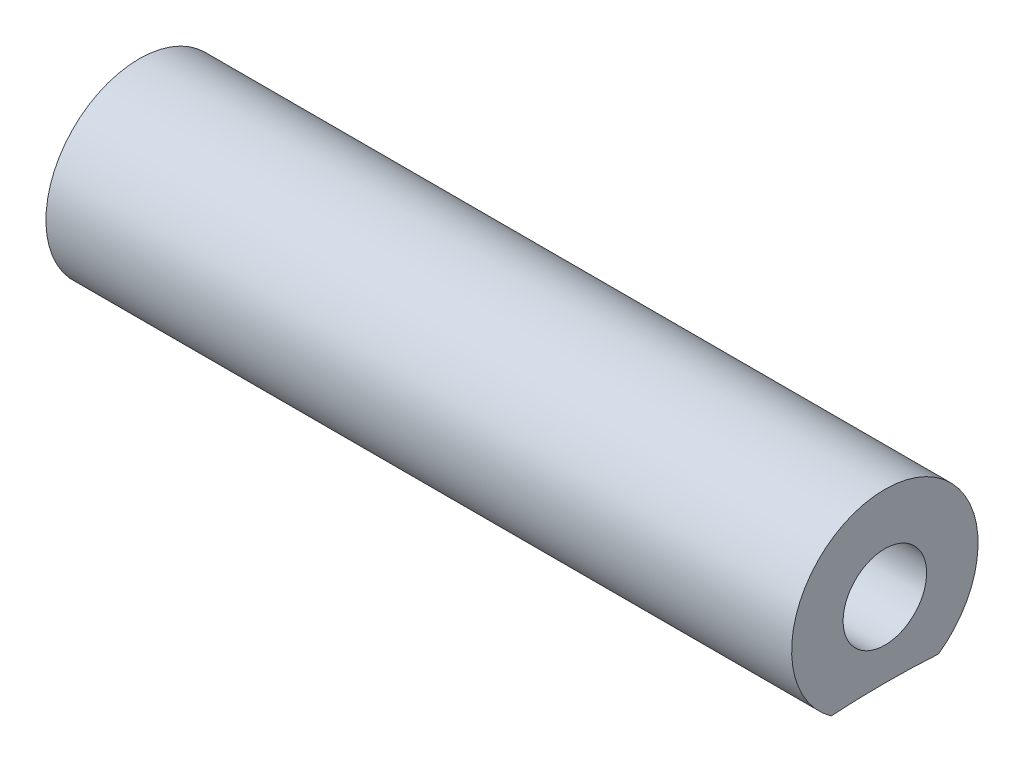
SolidWorks part; units mm, degrees
ref_plane "Front Plane" through (0, 0, 0) normal (0, 0, 1) x (1, 0, 0)
ref_plane "Top Plane" through (0, 0, 0) normal (0, 1, 0) x (1, 0, 0)
ref_plane "Right Plane" through (0, 0, 0) normal (1, 0, 0) x (0, 0, -1)
sketch "Sketch1" plane through (0, 0, 0) normal (1, 0, 0) x (0, 0, -1)
  circle A0 centre (0, 0) radius 3.175
  dimension "D1" = 6.35
extrude "Extrude1" add sketch "Sketch1" along normal blind 25.4
sketch "Sketch2" plane through (0, 0, 0) normal (-1, 0, 0) x (0, 0, 1)
  circle A0 centre (0, -31.623) radius 29.083
  circle A1 centre (0, 0) radius 3.175 construction
  dimension "D1" = 58.166
  dimension "D2" = 31.623
extrude "Cut-Extrude1" cut sketch "Sketch2" against normal through all
hole_wizard "#4-40 Tapped Hole1" positions "Sketch6" profile "Sketch5" tap size "#4-40" standard "Ansi Inch"
sketch "Sketch6" plane through (0, 0, 0) normal (1, 0, 0) x (0, 0, -1)
  point P0 (0, 0)
sketch "Sketch5" plane through (0, 0, 0) normal (0, 1, 0) x (0, 0, 1)
  line L0 (0, 0) -> (0, 25.4)
  line L1 (0, 25.4) -> (1.4224, 25.4)
  line L2 (1.4224, 25.4) -> (1.4224, 0)
  line L5 (1.4224, 0) -> (0, 0)
  line L11 (0, -6.35) -> (0, 107.95) construction
  dimension "Thread Major Dia." = 2.8448
  dimension "Thru Tap Drill Depth" = 25.4
